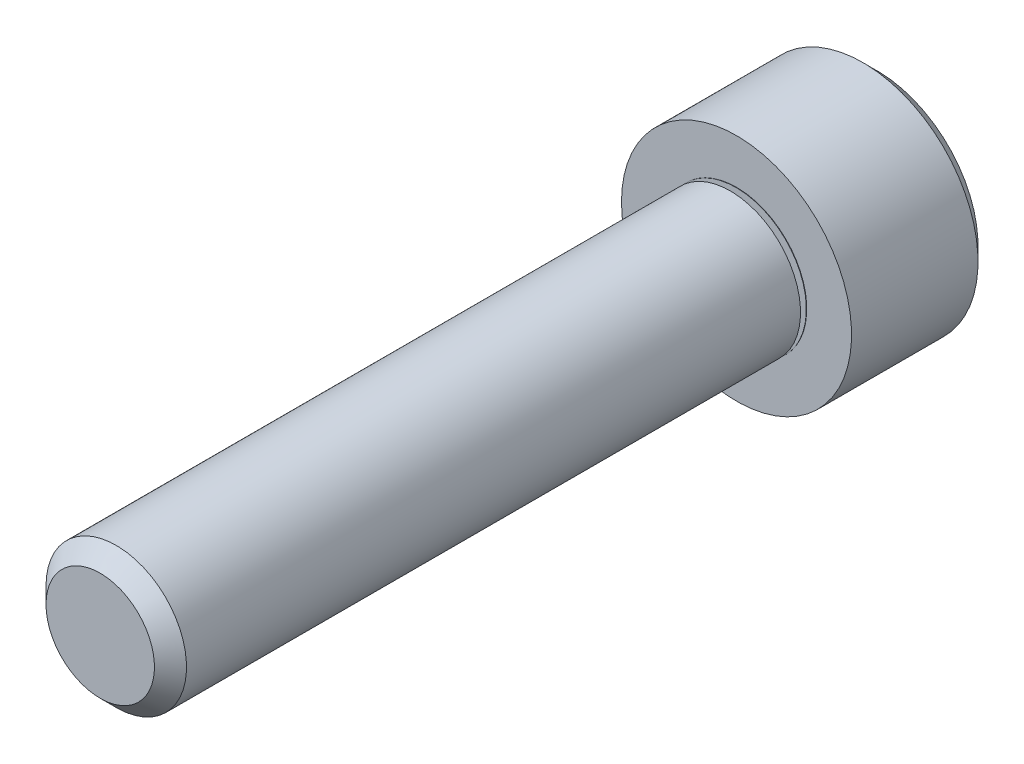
SolidWorks part; units mm, degrees
ref_plane "Front" through (0, 0, 0) normal (0, 0, 1) x (1, 0, 0)
ref_plane "Top" through (0, 0, 0) normal (0, 1, 0) x (1, 0, 0)
ref_plane "Right" through (0, 0, 0) normal (1, 0, 0) x (0, 0, -1)
sketch "Logo3_Revol_Axis" plane through (0, 0, 0) normal (0, 1, 0) x (1, 0, 0)
  line L0 (0, -43.5172) -> (0, 43.5172) construction
sketch "Logo3_bib1" plane through (0, 0, 0) normal (0, -1, 0) x (-1, 0, 0)
  line L0 (0, -15.875) -> (0, 3.5052)
  line L1 (0, 3.5052) -> (2.5197, 3.5052)
  line L2 (2.8702, 3.1547) -> (2.8702, 0)
  line L3 (2.8702, 0) -> (1.7526, 0)
  line L4 (1.7526, 0) -> (1.7526, -0.01)
  line L5 (1.7526, -15.4749) -> (1.3526, -15.875)
  line L6 (1.3526, -15.875) -> (0, -15.875)
  line L7 (1.7526, -0.01) -> (1.466, -0.01)
  line L8 (1.4591, -0.0488) -> (1.7526, -0.1556)
  line L9 (1.7526, -0.1556) -> (1.7526, -15.4749)
  line L10 (0, 10.5852) -> (0, -63.2873) construction
  line L11 (2.5197, 3.5052) -> (2.8702, 3.1547)
  arc A1 (1.466, -0.01) -> (1.4591, -0.0488) centre (1.466, -0.03) ccw
  point P17 (1.3526, -0.01)
  point P19 (2.8702, 3.5052)
revolve "Revolve1" add sketch "Logo3_bib1" angle 360 about L10
sketch "Logo3_bib2" plane through (0, 0, -3.5052) normal (0, 0, -1) x (1, 0, 0)
  line L1 (1.604, 0) -> (0.802, 1.3891)
  line L2 (0.802, 1.3891) -> (-0.802, 1.3891)
  line L3 (-0.802, 1.3891) -> (-1.604, 0)
  line L4 (-1.604, 0) -> (-0.802, -1.3891)
  line L5 (-0.802, -1.3891) -> (0.802, -1.3891)
  line L6 (0.802, -1.3891) -> (1.604, 0)
  circle A0 centre (0, 0) radius 1.3891 construction
  dimension "Logo3_c1" = 2.7781
extrude "Cut-Extrude1" cut sketch "Logo3_bib2" against normal blind 1.7526
equation "\"DIA2@Logo3_bib1\" = \"Logo3_d1-pas@Logo3_bib1\""
equation "\"LGT1@Logo3_bib1\" = \"Logo3_d1@Logo3_bib1\""
equation "\"D1@Cut-Extrude1\" = \"Logo3_d1@Logo3_bib1\"/2."
equation "\"D2@Cosmetic Thread1\" = \"Logo3_d1-pas@Logo3_bib1\""
equation "\"D5@Logo3_bib1\"=\"Logo3_d1@Logo3_bib1\"*.1"
